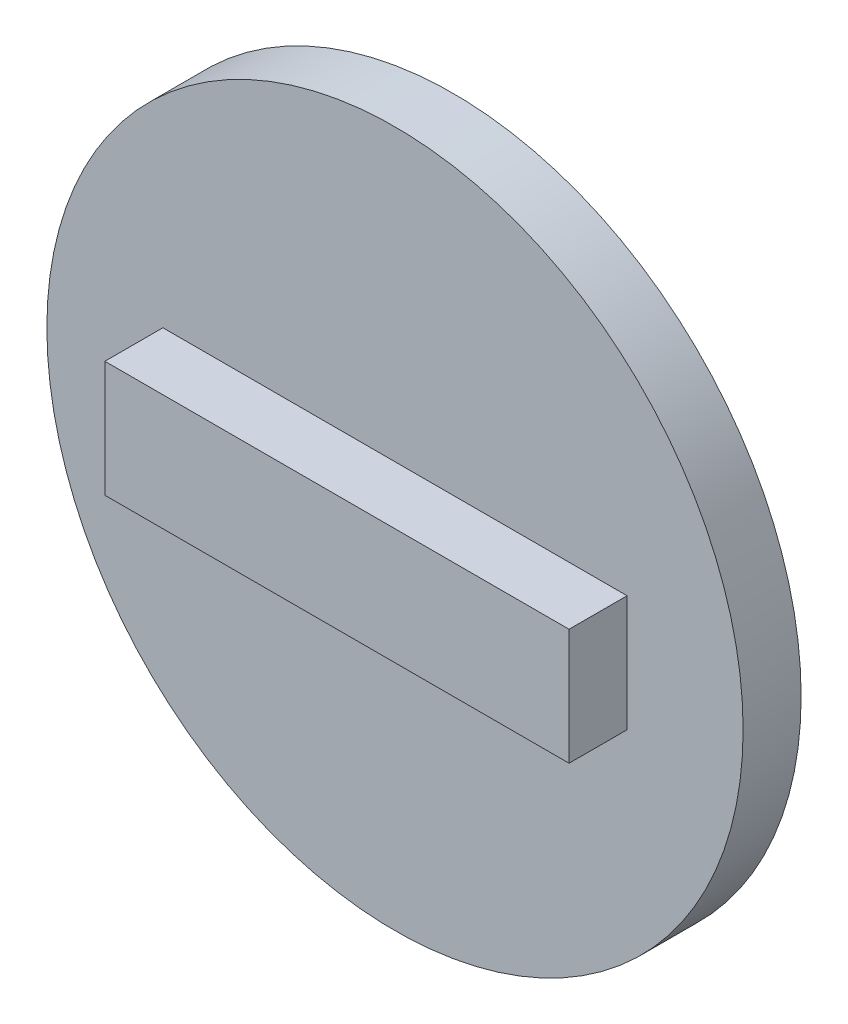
SolidWorks part; units mm, degrees
ref_plane "Front Plane" through (0, 0, 0) normal (0, 0, 1) x (1, 0, 0)
ref_plane "Top Plane" through (0, 0, 0) normal (0, 1, 0) x (1, 0, 0)
ref_plane "Right Plane" through (0, 0, 0) normal (1, 0, 0) x (0, 0, -1)
sketch "Sketch1" plane through (0, 0, 0) normal (0, 0, 1) x (1, 0, 0)
  circle A0 centre (0, 0) radius 19.05
  dimension "D1" = 38.1
extrude "Extrude1" add sketch "Sketch1" along normal blind 3.175
sketch "Sketch2" plane through (0, 0, 3.175) normal (0, 0, 1) x (1, 0, 0)
  line L1 (-12.7, 3.175) -> (12.7, 3.175)
  line L2 (-12.7, 3.175) -> (-12.7, -3.175)
  line L3 (-12.7, -3.175) -> (12.7, -3.175)
  line L4 (12.7, 3.175) -> (12.7, -3.175)
  circle A1 centre (0, 0) radius 19.05 construction
  dimension "D1" = 12.7
  dimension "D4" = 6.35
  dimension "D2" = 25.4
  dimension "D3" = 3.175
extrude "Extrude2" add sketch "Sketch2" along normal blind 3.175
